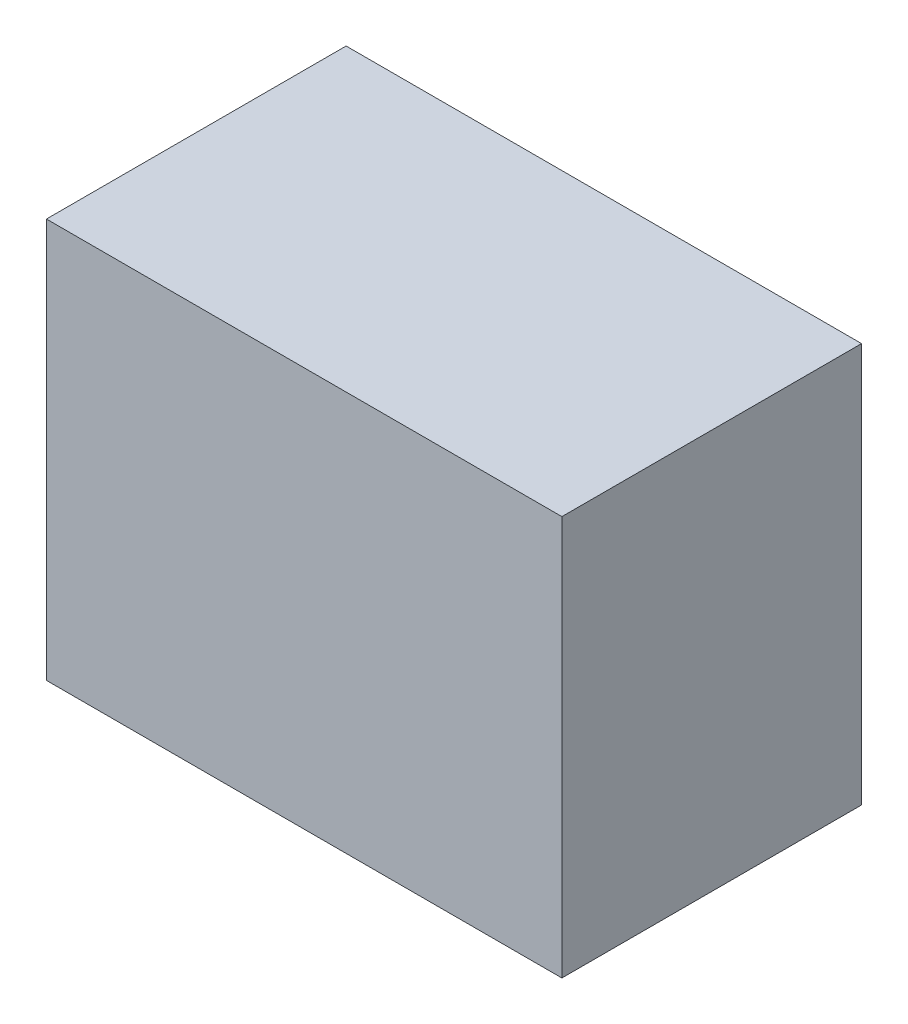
SolidWorks part; units mm, degrees
ref_plane "Front Plane" through (0, 0, 0) normal (0, 0, 1) x (1, 0, 0)
ref_plane "Top Plane" through (0, 0, 0) normal (0, 1, 0) x (1, 0, 0)
ref_plane "Right Plane" through (0, 0, 0) normal (1, 0, 0) x (0, 0, -1)
sketch "Sketch2" plane through (0, 0, 0) normal (0, 1, 0) x (1, 0, 0)
  line L1 (0, 0) -> (25.8, 0)
  line L2 (0, 0) -> (0, 15)
  line L3 (0, 15) -> (25.8, 15)
  line L4 (25.8, 0) -> (25.8, 15)
extrude "Boss-Extrude1" add sketch "Sketch2" along normal blind 20
